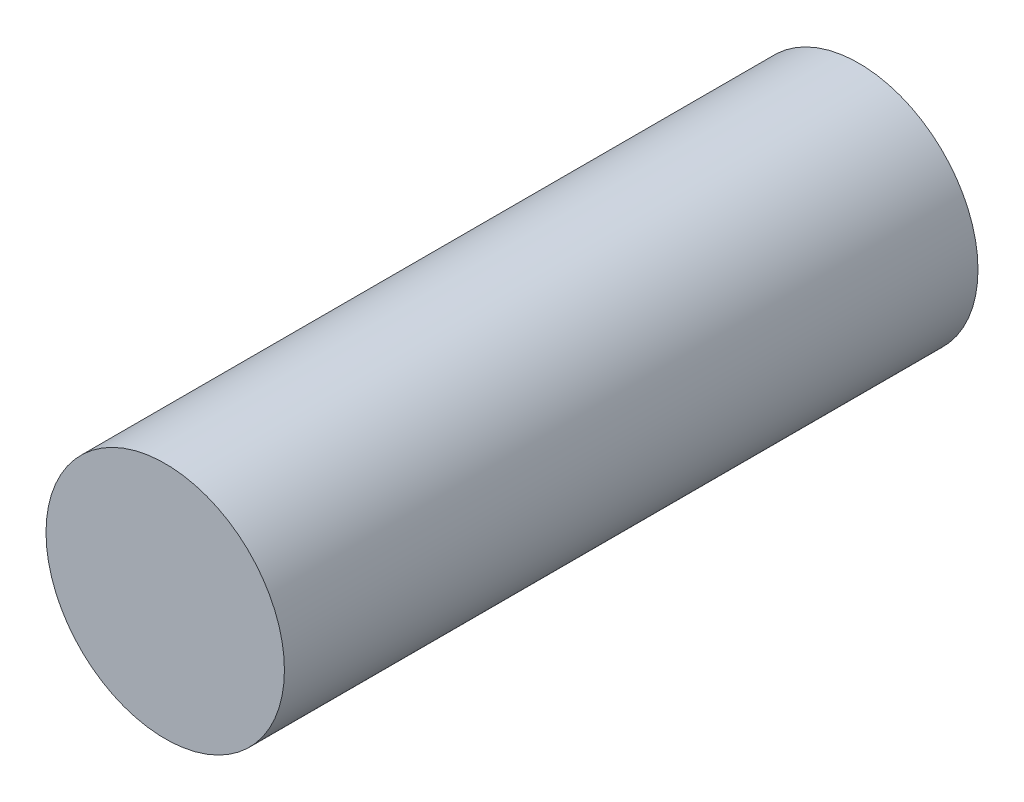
SolidWorks part; units mm, degrees
ref_plane "Plan de face" through (0, 0, 0) normal (0, 0, 1) x (1, 0, 0)
ref_plane "Plan de dessus" through (0, 0, 0) normal (0, 1, 0) x (1, 0, 0)
ref_plane "Plan de droite" through (0, 0, 0) normal (1, 0, 0) x (0, 0, -1)
sketch "Esquisse1" plane through (0, 0, 0) normal (0, 0, 1) x (1, 0, 0)
  circle A0 centre (0, 0) radius 27.5
  dimension "D1" = 55
extrude "Boss.-Extru.1" add sketch "Esquisse1" along normal blind 160
